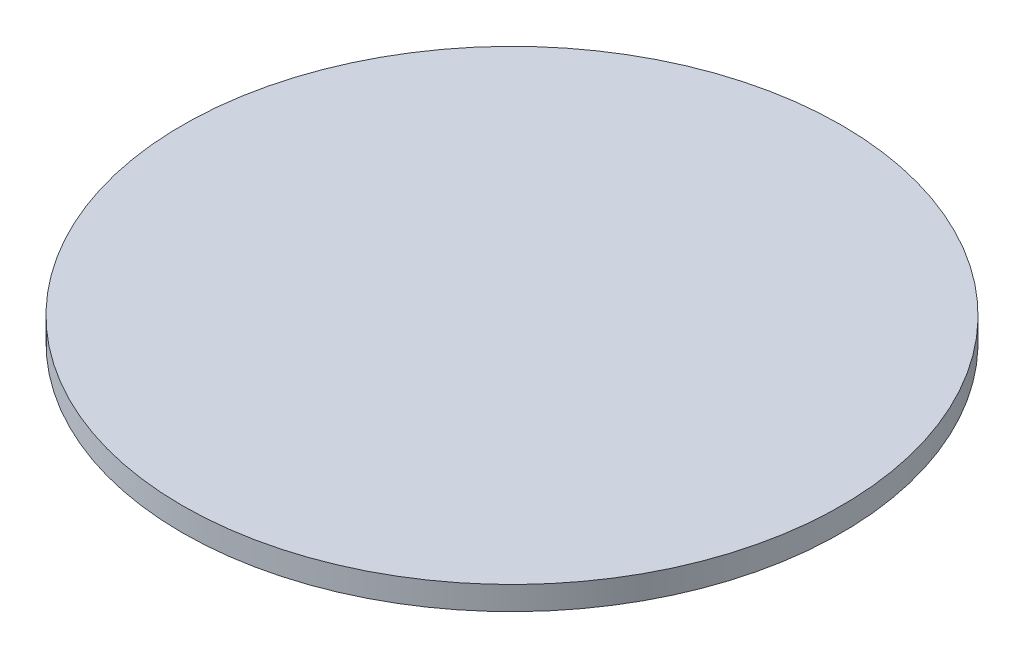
SolidWorks part; units mm, degrees
ref_plane "Front Plane" through (0, 0, 0) normal (0, 0, 1) x (1, 0, 0)
ref_plane "Top Plane" through (0, 0, 0) normal (0, 1, 0) x (1, 0, 0)
ref_plane "Right Plane" through (0, 0, 0) normal (1, 0, 0) x (0, 0, -1)
sketch "Sketch1" plane through (0, 0, 0) normal (0, 1, 0) x (1, 0, 0)
  circle A0 centre (0, 0) radius 44.45
  dimension "D1" = 88.9
extrude "Boss-Extrude1" add sketch "Sketch1" along normal blind 3.175
